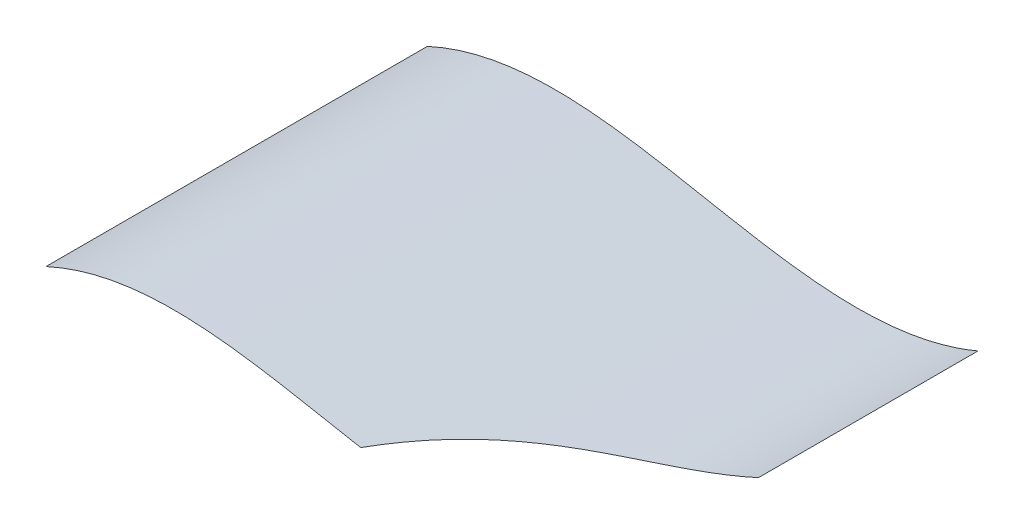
SolidWorks part; units mm, degrees
ref_plane "Front Plane" through (0, 0, 0) normal (0, 0, 1) x (1, 0, 0)
ref_plane "Top Plane" through (0, 0, 0) normal (0, 1, 0) x (1, 0, 0)
ref_plane "Right Plane" through (0, 0, 0) normal (1, 0, 0) x (0, 0, -1)
sketch "Sketch1" plane through (0, 0, 0) normal (0, 0, 1) x (1, 0, 0)
  spline S0 degree 3 poles (-97.2415, 0) (-20.1719, 35.3187) (56.1971, -27.981) (133.7743, 4.8352) knots 0 0 0 0 1 1 1 1
surface "Surface-Extrude1" sketch "Sketch1" parameters "D1"=160
sketch3d "3DSketch1"
  line L0 (133.7743, 4.8352, -80) -> (133.7743, 4.8352, 80) construction
  spline S0 degree 2 poles (34.8009, 0.2304, 80) (63.6149, -1.9452, 16.1713) (133.7743, 4.8352, 12.0924) knots 0 0 0 1 1 1
  spline S1 degree 3 poles (133.7743, 4.8352, 80) (56.1971, -27.981, 80) (-20.1719, 35.3187, 80) (-97.2415, 0, 80) knots 0 0 0 0 1 1 1 1 construction
surface "Surface-Trim1"
